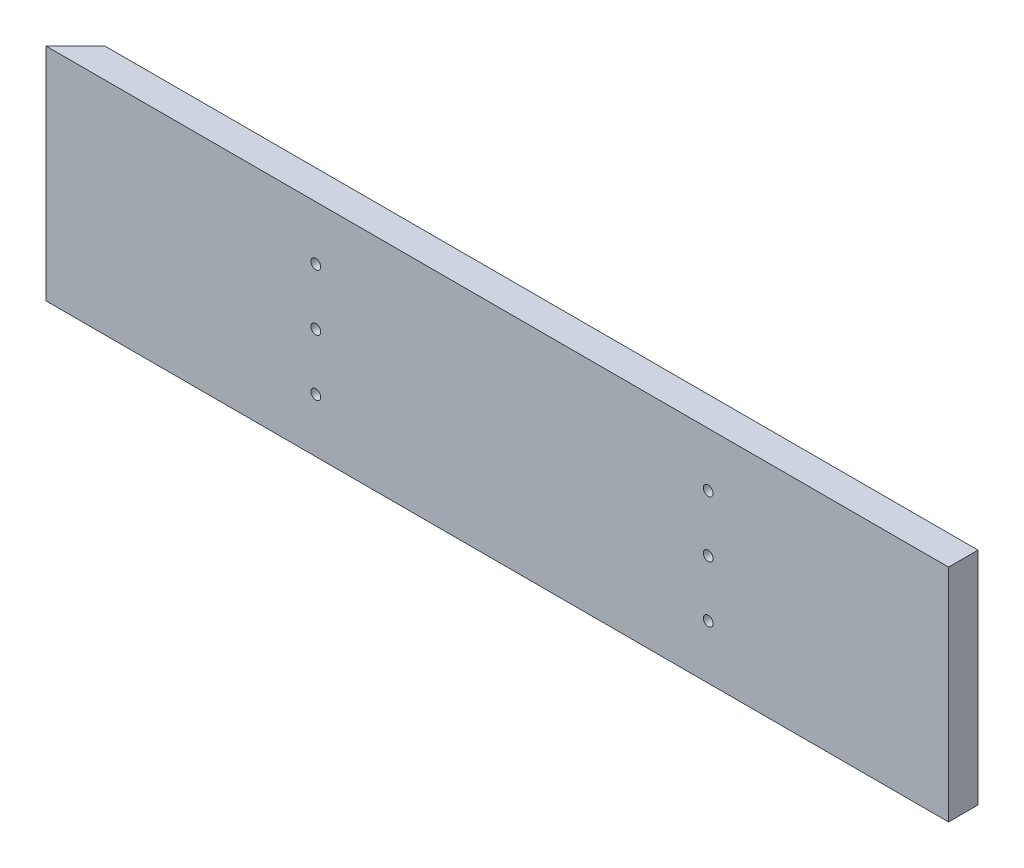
SolidWorks part; units mm, degrees
ref_plane "Front Plane" through (0, 0, 0) normal (0, 0, 1) x (1, 0, 0)
ref_plane "Top Plane" through (0, 0, 0) normal (0, 1, 0) x (1, 0, 0)
ref_plane "Right Plane" through (0, 0, 0) normal (1, 0, 0) x (0, 0, -1)
sketch "Sketch2" plane through (0, 0, 0) normal (1, 0, 0) x (0, 0, -1)
  line L1 (0, 0) -> (38.1, 0)
  line L2 (0, 0) -> (0, 285.75)
  line L3 (0, 285.75) -> (38.1, 285.75)
  line L4 (38.1, 0) -> (38.1, 285.75)
  line L5 (0, 0) -> (38.1, 285.75) construction
  line L6 (0, 285.75) -> (38.1, 0) construction
  point P5 (19.05, 142.875)
extrude "Boss-Extrude1" add sketch "Sketch2" along normal blind 1168.4
sketch "Sketch3" plane through (0, 0, 0) normal (0, 0, 1) x (1, 0, 0)
  line L0 (349.25, 142.875) -> (0, 142.875) construction
  line L1 (0, 285.75) -> (0, 0) construction
  line L2 (857.25, 142.875) -> (1168.4, 142.875) construction
  line L3 (1168.4, 285.75) -> (1168.4, 0) construction
  line L4 (349.25, 69.85) -> (0, 69.85) construction
  line L5 (857.25, 69.85) -> (1168.4, 69.85) construction
  line L6 (1168.4, 0) -> (0, 0) construction
  line L7 (349.25, 215.9) -> (0, 215.9) construction
  line L8 (857.25, 215.9) -> (1168.4, 215.9) construction
  line L9 (1168.4, 285.75) -> (0, 285.75) construction
  circle A0 centre (349.25, 142.875) radius 6.35
  circle A1 centre (857.25, 142.875) radius 6.35
  circle A2 centre (349.25, 69.85) radius 6.35
  circle A3 centre (857.25, 69.85) radius 6.35
  circle A4 centre (349.25, 215.9) radius 6.35
  circle A5 centre (857.25, 215.9) radius 6.35
extrude "Cut-Extrude1" cut sketch "Sketch3" against normal through all
sketch "Sketch4" plane through (0, 285.75, 0) normal (0, 1, 0) x (1, 0, 0)
  line L0 (0, 0) -> (38.1, 38.1)
  line L1 (1168.4, 38.1) -> (0, 38.1) construction
  line L2 (38.1, 38.1) -> (0, 38.1)
  line L3 (0, 38.1) -> (0, 0)
extrude "Cut-Extrude2" cut sketch "Sketch4" against normal through all
equation "\"system_width\"= 7ft + 10 "
equation "\"system_length\"= 95.5"
equation "\"system_step_width\"= 3ft"
equation "\"system_top_length\"= \"system_length\" - \"system_step_length\""
equation "\"module_width\"= (\"system_width\" -  2* \"module_trim_thickness\") / 2"
equation "\"module_length\"= (\"system_top_length\" - \"module_trim_thickness\")/ 2"
equation "\"module_board_length\"= 11.25in"
equation "\"module_board_width\"= 1.5in"
equation "\"module_board_long_depth\"= \"module_length\" - \"module_lip_width\""
equation "\"module_board_short_depth\"= \"module_width\" - ( 2 * \"module_board_width\" ) - \"module_lip_width\""
equation "\"module_board_hole\"= 0.5in"
equation "\"module_board_hole_position\"= ( ( \"module_width\" - \"module_board_hole_seperation\" ) / 2 ) + \"module_board_width\"/2"
equation "\"module_board_hole_seperation\"= 20in"
equation "\"module_top_thickness\"= 0.75in"
equation "\"module_lip_width\"= 1.5in"
equation "\"module_trim_thickness\"= 1in"
equation "\"module_trim_height\"= 14in"
equation "\"D1@Sketch2\"=\"module_lip_width\""
equation "\"D2@Sketch2\"=\"module_board_length\""
equation "\"D1@Boss-Extrude1\"=\"module_width\""
equation "\"D1@Sketch3\"=\"module_board_hole_seperation\""
equation "\"D2@Sketch3\"=\"module_board_hole\""
equation "\"D3@Sketch3\"=\"module_board_length\"/2"
equation "\"D4@Sketch3\"=\"module_board_hole\""
equation "\"D5@Sketch3\"=\"module_board_hole_seperation\""
equation "\"module_top_length\"= \"module_length\" + \"module_lip_width\""
equation "\"module_top_width\"= \"module_width\" + \"module_lip_width\""
equation "\"step_board_length\"= 5.5in"
equation "\"D6@Sketch3\"=\"step_board_length\"/2"
equation "\"D1@Sketch4\"=\"module_lip_width\""
equation "\"D7@Sketch3\"=\"module_board_hole_seperation\""
equation "\"D8@Sketch3\"=\"step_board_length\"/2"
equation "\"D9@Sketch3\"=\"module_board_hole\""
equation "\"D10@Sketch3\"=\"module_board_hole_position\""
equation "\"step_board_width\"= 1.5in"
equation "\"system_step_length\"= 2ft+11.5"
equation "\"module_top_overhang\"= 4.5in"
equation "\"module_trim_angle\"= 45deg"
equation "\"step_module_width\"= \"module_width\""
equation "\"step_module_length\"= \"system_step_length\" - \"module_trim_thickness\""
equation "\"step_board_short_depth\"= \"step_module_length\" - \"module_lip_width\""
equation "\"step_board_long_depth\"= \"step_module_width\" - (2 * \"module_board_width\") - \"module_lip_width\""
